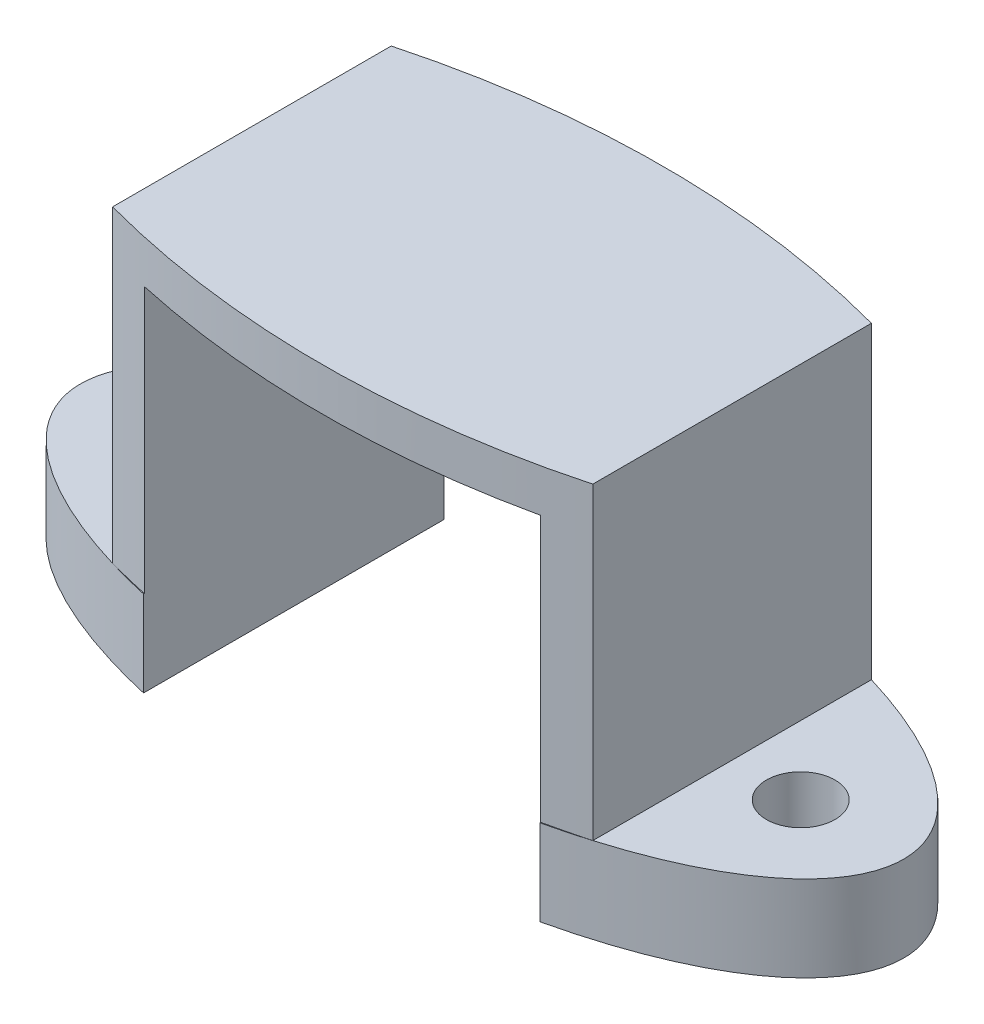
SolidWorks part; units mm, degrees
ref_plane "Front Plane" through (0, 0, 0) normal (0, 0, 1) x (1, 0, 0)
ref_plane "Top Plane" through (0, 0, 0) normal (0, 1, 0) x (1, 0, 0)
ref_plane "Right Plane" through (0, 0, 0) normal (1, 0, 0) x (0, 0, -1)
sketch "Sketch2" plane through (0, 0, 0) normal (0, 1, 0) x (1, 0, 0)
  ellipse E0 centre (0, 0) end of major axis (12, 0) minor radius 5
extrude "Boss-Extrude1" add sketch "Sketch2" along normal blind 2.5
sketch "Sketch3" plane through (0, 2.5, 0) normal (0, 1, 0) x (1, 0, 0)
  circle A0 centre (9, 0) radius 1
  circle A1 centre (-9, 0) radius 1
  dimension "D1" = 18
  dimension "D2" = 9
extrude "Cut-Extrude1" cut sketch "Sketch3" against normal blind 2.5
sketch "Sketch10" plane through (0, 2.5, 0) normal (0, 1, 0) x (1, 0, 0)
  line L0 (-7, -4.0612) -> (-7, 4.0612)
  line L1 (7, -4.0612) -> (7, 4.0612)
  arc A0 (-7, 4.0612) -> (7, 4.0612) centre (0, -21.915) cw
  arc A1 (-7, -4.0612) -> (7, -4.0612) centre (0, 21.9152) ccw
  ellipse E0 centre (0, 0) end of major axis (12, 0) minor radius 5 construction
  point P0 (7, 0)
  point P1 (-7, 0)
  point P12 (-7, 0)
  point P15 (7, 0)
  point P16 (0, -5)
  dimension "D1" = 7
  dimension "D2" = 7
extrude "Boss-Extrude3" add sketch "Sketch10" along normal blind 9
ref_plane "Plane1" through (0, 0, 10) normal (0, 0, 1) x (1, 0, 0)
sketch "Sketch11" plane through (0, 0, 10) normal (0, 0, 1) x (1, 0, 0)
  line L0 (-5.775, 0) -> (5.775, 0)
  line L1 (15.1989, 0) -> (-15.1989, 0) construction
  line L2 (5.775, 0) -> (5.775, 10.25)
  line L3 (5.775, 10.25) -> (-5.775, 10.25)
  line L4 (-5.775, 10.25) -> (-5.775, 0)
  point P6 (0, 0)
  dimension "D1" = 5.775
extrude "Cut-Extrude3" cut sketch "Sketch11" against normal blind 20
